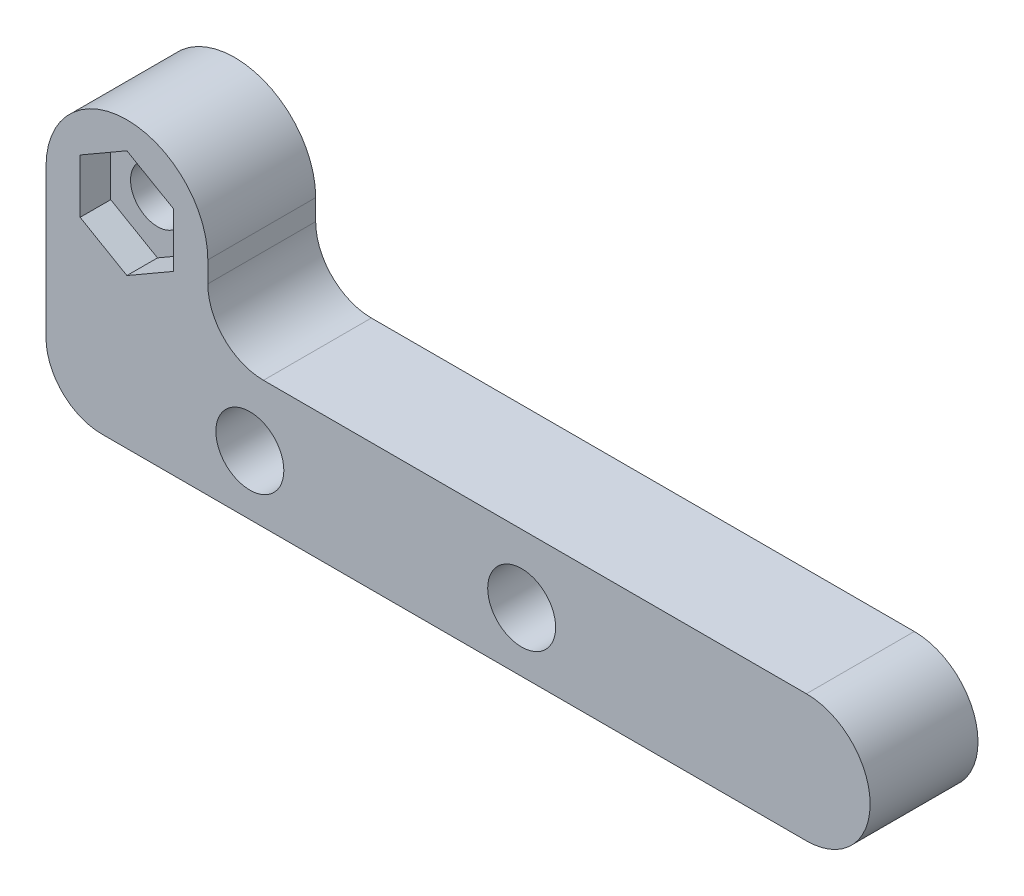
SolidWorks part; units mm, degrees
ref_plane "Front Plane" through (0, 0, 0) normal (0, 0, 1) x (1, 0, 0)
ref_plane "Top Plane" through (0, 0, 0) normal (0, 1, 0) x (1, 0, 0)
ref_plane "Right Plane" through (0, 0, 0) normal (1, 0, 0) x (0, 0, -1)
sketch "Sketch1" plane through (0, 0, 0) normal (0, 0, 1) x (1, 0, 0)
  line L0 (-6.259, -4.5) -> (-6.259, -8.25) construction
  line L1 (-6.259, -8.25) -> (-6.259, -12) construction
  line L2 (0, 0) -> (-19.2633, 0) construction
  line L3 (-11.0215, 0) -> (38.9785, 0) construction
  line L6 (-11.0215, -8.25) -> (28.9785, -8.25) construction
  line L11 (-6.259, 0) -> (-15.784, 0)
  line L12 (-6.259, 0) -> (-6.259, -4.5)
  line L13 (-11.0215, -4.5) -> (28.9785, -4.5)
  line L14 (-11.0215, -12) -> (28.9785, -12)
  line L16 (-11.045, -4.7624) -> (-10.998, -4.7624) construction
  line L20 (-6.259, -12) -> (-15.784, -12)
  line L21 (-15.784, 0) -> (-15.784, -12)
  arc A0 (-9.4622, -4.5) -> (-6.259, 0) centre (-11.0215, 0) ccw construction
  arc A2 (-11.045, -4.7624) -> (-10.998, -4.7624) centre (-11.0215, 0) ccw construction
  circle A3 centre (-11.0215, 0) radius 1.5875
  arc A4 (-11.0215, 4.7625) -> (-15.784, 0) centre (-11.0215, 0) ccw
  arc A6 (-11.0215, -4.5) -> (-11.0215, -12) centre (-11.0215, -8.25) ccw
  arc A7 (28.9785, -12) -> (28.9785, -4.5) centre (28.9785, -8.25) ccw
  arc A8 (-12.0624, -4.6474) -> (-11.045, -4.7624) centre (-11.0215, 0) ccw construction
  arc A9 (-15.784, 0) -> (-14.3891, -3.3676) centre (-11.0215, 0) ccw construction
  arc A10 (-12.0624, -4.6474) -> (-11.045, -4.7624) centre (-11.0215, 0) ccw construction
  arc A11 (-6.259, 0) -> (-15.784, 0) centre (-11.0215, 0) ccw
  arc A12 (-15.784, 0) -> (-14.3891, -3.3676) centre (-11.0215, 0) ccw construction
  arc A13 (-14.3891, -3.3676) -> (-12.0624, -4.6474) centre (-11.0215, 0) ccw construction
  arc A14 (-14.3891, -3.3676) -> (-12.0624, -4.6474) centre (-11.0215, 0) ccw construction
  arc A15 (-14.3891, -3.3676) -> (-12.0624, -4.6474) centre (-11.0215, 0) ccw construction
  arc A16 (-12.0624, -4.6474) -> (-11.045, -4.7624) centre (-11.0215, 0) ccw construction
  arc A17 (-10.998, -4.7624) -> (-9.6176, -4.5509) centre (-11.0215, 0) ccw construction
  point P16 (-11.0215, 0)
  point P23 (8.9785, -8.25)
  dimension "D1" = 9.525
  dimension "D2" = 3.175
  dimension "D6" = 3.75
  dimension "D3" = 40
  dimension "D4" = 12
extrude "Boss-Extrude1" add sketch "Sketch1" along normal blind 6.35
sketch "Sketch3" plane through (-15.784, 0, 0) normal (-1, 0, 0) x (0, 0, 1)
  line L2 (6.35, 0) -> (6.35, -12) construction
  circle A0 centre (3.9688, 0) radius 1.75
  dimension "D2" = 3.5
  dimension "D1" = 2.3812
  dimension "D3" = 4.7625
extrude "Cut-Extrude2" cut sketch "Sketch3" against normal blind 1.905
chamfer "Chamfer1" distance 0.5 angle 45 2 edges at (-15.4534, 1.7435, 4.1193) (-15.784, -1.75, 3.9688)
fillet "Fillet1" radius 3.2766 2 edges at (-15.784, -12, 3.175) (-6.259, -4.5, 3.175)
sketch "Sketch7" plane through (0, 0, 6.35) normal (0, 0, 1) x (1, 0, 0)
  line L0 (-15.784, 0) -> (-15.784, -8.7234) construction
  line L1 (-13.7755, -1.59) -> (-11.0215, -3.18)
  line L2 (-11.0215, -3.18) -> (-8.2675, -1.59)
  line L3 (-8.2675, -1.59) -> (-8.2675, 1.59)
  line L4 (-8.2675, 1.59) -> (-11.0215, 3.18)
  line L5 (-11.0215, 3.18) -> (-13.7755, 1.59)
  line L6 (-13.7755, 1.59) -> (-13.7755, -1.59)
  line L8 (28.9785, -12) -> (-12.5074, -12) construction
  circle A2 centre (-11.0215, 0) radius 2.754 construction
  dimension "D1" = 3.18
  dimension "D2" = 2.0085
  dimension "D3" = 8.82
extrude "Cut-Extrude3" cut sketch "Sketch7" against normal blind 1.8
sketch "Sketch8" plane through (0, 0, 0) normal (0, 0, -1) x (-1, 0, 0)
  line L0 (15.784, 0) -> (15.784, -8.7234) construction
  line L1 (-4.216, -8.5) -> (-4.216, -6.3324) construction
  line L4 (-28.9785, -12) -> (12.5074, -12) construction
  circle A2 centre (-12.216, -8.5) radius 2
  circle A13 centre (3.784, -8.5) radius 2
  dimension "D2" = 4
  dimension "D4" = 20
  dimension "D3" = 8
  dimension "D1" = 3.5
extrude "Cut-Extrude4" cut sketch "Sketch8" against normal blind 10 contours A2 | A13
